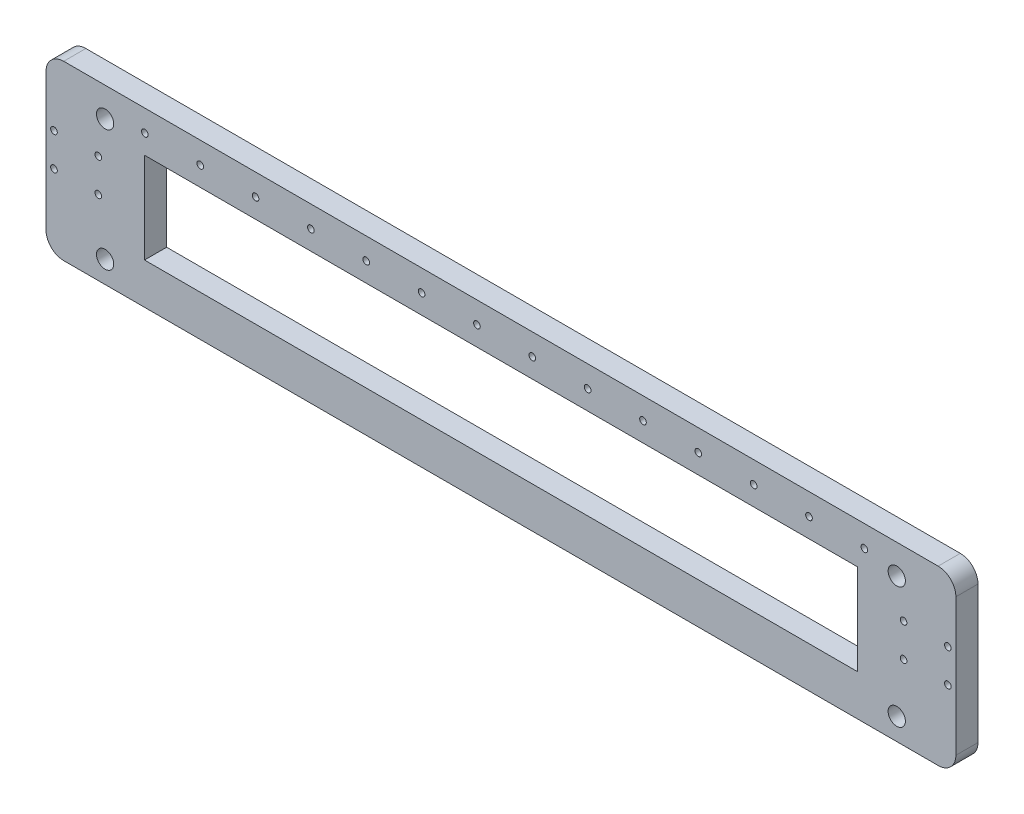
SolidWorks part; units mm, degrees
ref_plane "Front Plane" through (0, 0, 0) normal (0, 0, 1) x (1, 0, 0)
ref_plane "Top Plane" through (0, 0, 0) normal (0, 1, 0) x (1, 0, 0)
ref_plane "Right Plane" through (0, 0, 0) normal (1, 0, 0) x (0, 0, -1)
sketch "Sketch1" plane through (0, 0, 0) normal (0, 0, 1) x (1, 0, 0)
  line L1 (-197.5, 39) -> (197.5, 39)
  line L2 (-205.5, 31) -> (-205.5, -31)
  line L3 (-197.5, -39) -> (197.5, -39)
  line L4 (205.5, 31) -> (205.5, -31)
  line L5 (-205.5, 39) -> (205.5, -39) construction
  line L6 (-205.5, -39) -> (205.5, 39) construction
  line L7 (-161, 20.5) -> (161, 20.5)
  line L8 (-161, 20.5) -> (-161, -20.5)
  line L9 (-161, -20.5) -> (161, -20.5)
  line L10 (161, 20.5) -> (161, -20.5)
  line L11 (-161, 20.5) -> (161, -20.5) construction
  line L12 (-161, -20.5) -> (161, 20.5) construction
  arc A0 (197.5, -39) -> (205.5, -31) centre (197.5, -31) ccw
  arc A1 (205.5, 31) -> (197.5, 39) centre (197.5, 31) ccw
  arc A2 (-197.5, -39) -> (-205.5, -31) centre (-197.5, -31) cw
  arc A3 (-205.5, 31) -> (-197.5, 39) centre (-197.5, 31) cw
  point P0 (0, 0)
  point P18 (0, 0)
  dimension "D3" = 8
  dimension "D1" = 411
  dimension "D2" = 78
  dimension "D4" = 322
  dimension "D5" = 41
extrude "Boss-Extrude1" add sketch "Sketch1" along normal blind 10
sketch "Sketch2" plane through (0, 0, 10) normal (0, 0, 1) x (1, 0, 0)
  line L0 (205.5, -31) -> (205.5, 31) construction
  line L1 (197.5, 39) -> (-197.5, 39) construction
  line L2 (161, -20.5) -> (161, 20.5) construction
  line L3 (-197.5, -39) -> (197.5, -39) construction
  line L4 (0, 82.8552) -> (0, -82.9475) construction
  circle A0 centre (178.8, 25.8) radius 3.9
  circle A1 centre (181.88, 9.7) radius 1.5
  circle A2 centre (201.9, 9.7) radius 1.5
  circle A3 centre (181.88, -5.3) radius 1.5
  circle A4 centre (201.9, -5.3) radius 1.5
  circle A5 centre (178.8, -29.1) radius 3.9
  circle A6 centre (-178.8, -29.1) radius 3.9
  circle A7 centre (-201.9, -5.3) radius 1.5
  circle A8 centre (-181.88, -5.3) radius 1.5
  circle A9 centre (-201.9, 9.7) radius 1.5
  circle A10 centre (-181.88, 9.7) radius 1.5
  circle A11 centre (-178.8, 25.8) radius 3.9
  dimension "D1" = 7.8
  dimension "D4" = 3
  dimension "D5" = 3
  dimension "D6" = 3
  dimension "D7" = 3
  dimension "D17" = 7.8
  dimension "D2" = 26.7
  dimension "D3" = 13.2
  dimension "D8" = 3.6
  dimension "D9" = 3.6
  dimension "D10" = 20.02
  dimension "D11" = 20.02
  dimension "D12" = 29.3
  dimension "D13" = 29.3
  dimension "D14" = 15
  dimension "D15" = 15
  dimension "D16" = 20.88
  dimension "D18" = 9.9
  dimension "D19" = 26.7
extrude "Cut-Extrude1" cut sketch "Sketch2" against normal blind 15
sketch "Sketch3" plane through (0, 0, 10) normal (0, 0, 1) x (1, 0, 0)
  line L11 (12.6646, 29.2353) -> (15.6646, 29.2353) construction
  circle A15 centre (-160.8354, 29.2353) radius 1.5
  circle A16 centre (-135.8354, 29.2353) radius 1.5
  circle A17 centre (-110.8354, 29.2353) radius 1.5
  circle A18 centre (-85.8354, 29.2353) radius 1.5
  circle A19 centre (-60.8354, 29.2353) radius 1.5
  circle A20 centre (-35.8354, 29.2353) radius 1.5
  circle A21 centre (-10.8354, 29.2353) radius 1.5
  circle A22 centre (14.1646, 29.2353) radius 1.5
  circle A23 centre (39.1646, 29.2353) radius 1.5
  circle A24 centre (64.1646, 29.2353) radius 1.5
  circle A25 centre (89.1646, 29.2353) radius 1.5
  circle A26 centre (114.1646, 29.2353) radius 1.5
  circle A27 centre (139.1646, 29.2353) radius 1.5
  circle A28 centre (164.1646, 29.2353) radius 1.5
  point P0 (-10.8354, 29.2353)
  dimension "D31" = 3
  dimension "D32" = 3
  dimension "D33" = 3
  dimension "D34" = 3
  dimension "D35" = 3
  dimension "D36" = 3
  dimension "D37" = 3
  dimension "D38" = 3
  dimension "D39" = 3
  dimension "D40" = 3
  dimension "D41" = 3
  dimension "D42" = 3
  dimension "D43" = 3
  dimension "D44" = 3
  dimension "D4" = 25
  dimension "D6" = 25
  dimension "D8" = 25
  dimension "D10" = 25
  dimension "D12" = 25
  dimension "D14" = 25
  dimension "D16" = 25
  dimension "D18" = 25
  dimension "D19" = 25
  dimension "D20" = 25
  dimension "D21" = 25
  dimension "D22" = 25
  dimension "D23" = 25
  dimension "D30" = 25
extrude "Cut-Extrude2" cut sketch "Sketch3" against normal blind 15
